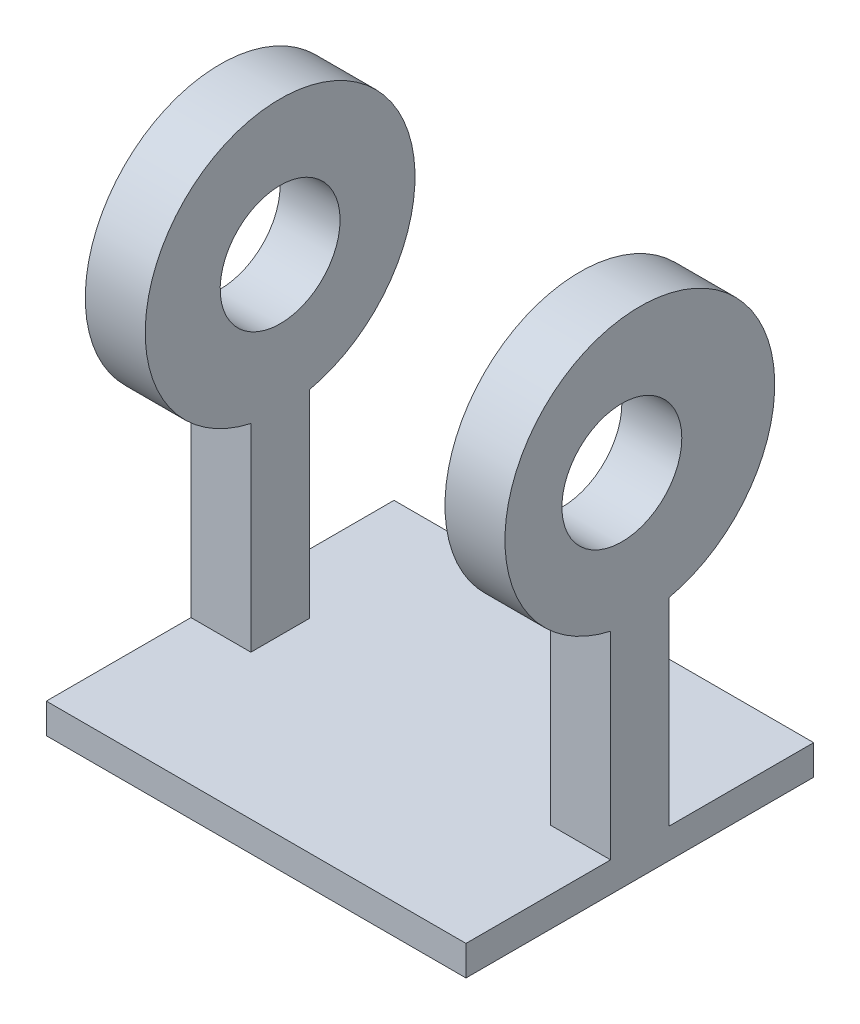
SolidWorks part; units mm, degrees
ref_plane "Plan de face" through (0, 0, 0) normal (0, 0, 1) x (1, 0, 0)
ref_plane "Plan de dessus" through (0, 0, 0) normal (0, 1, 0) x (1, 0, 0)
ref_plane "Plan de droite" through (0, 0, 0) normal (1, 0, 0) x (0, 0, -1)
sketch "Esquisse3" plane through (0, 0, 0) normal (1, 0, 0) x (0, 0, -1)
  line L0 (0, 0) -> (24.125, 0)
  line L1 (24.125, 0) -> (24.125, -5)
  line L2 (24.125, -5) -> (-33.875, -5)
  line L3 (-33.875, -5) -> (-33.875, 0)
  line L4 (-33.875, 0) -> (-9.75, 0)
  line L5 (-9.75, 0) -> (-9.75, 33.0345)
  line L6 (-9.75, 33.0345) -> (0, 33.0345)
  line L7 (0, 33.0345) -> (0, 0)
  circle A0 centre (-4.875, 55) radius 22.5
  circle A1 centre (-4.875, 55) radius 10
  dimension "D6" = 45
  dimension "D7" = 20
  dimension "D1" = 5
  dimension "D2" = 9.75
  dimension "D3" = 58
  dimension "D4" = 24.125
  dimension "D5" = 24.125
  dimension "D8" = 60
extrude "Boss.-Extru.1" add sketch "Esquisse3" along normal blind 70 contours L0 L1 L2 L3 L4 L5 L6 L7
sketch "Esquisse4" plane through (70, 0, 0) normal (1, 0, 0) x (0, 0, -1)
  circle A0 centre (-4.875, 55) radius 22.5
  circle A1 centre (-4.875, 55) radius 10
  dimension "D1" = 20
  dimension "D2" = 45
extrude "Boss.-Extru.2" add sketch "Esquisse4" against normal blind 70
sketch "Esquisse5" plane through (0, 0, 9.75) normal (0, 0, 1) x (1, 0, 0)
  line L0 (70, 0) -> (0, 0) construction
  line L1 (10, 0) -> (60, 0)
  line L2 (10, 0) -> (10, 77.5)
  line L3 (10, 77.5) -> (60, 77.5)
  line L4 (60, 0) -> (60, 77.5)
  line L5 (70, 77.5) -> (0, 77.5) construction
  line L6 (0, 77.5) -> (0, 33.0345) construction
  dimension "D1" = 50
  dimension "D2" = 10
extrude "Enlèv. mat.-Extru.3" cut sketch "Esquisse5" against normal blind 43
sketch "Esquisse8" plane through (0, 0, 9.75) normal (0, 0, -1) x (-1, 0, 0)
  line L1 (-60, 33.0345) -> (-10, 33.0345)
  line L2 (-60, 33.0345) -> (-60, 76.9655)
  line L3 (-60, 76.9655) -> (-10, 76.9655)
  line L4 (-10, 33.0345) -> (-10, 76.9655)
extrude "Enlèv. mat.-Extru.4" cut sketch "Esquisse8" against normal blind 43
sketch "Esquisse9" plane through (70, 0, 0) normal (1, 0, 0) x (0, 0, -1)
  circle A0 centre (-4.875, 55) radius 10
extrude "Boss.-Extru.3" add sketch "Esquisse9" against normal up to surface (10 mm away)
sketch "Esquisse10" plane through (70, 0, 0) normal (1, 0, 0) x (0, 0, -1)
  line L0 (-33.5838, 55) -> (27.3634, 55) construction
  line L1 (-4.875, 81.5523) -> (-4.875, 25.5217) construction
  line L2 (-7.875, 81.5523) -> (-7.875, 38.9728) construction
  circle A0 centre (-7.875, 55) radius 10
  dimension "D2" = 20
  dimension "D1" = 3
extrude "Enlèv. mat.-Extru.5" cut sketch "Esquisse10" against normal up to surface (10 mm away)
